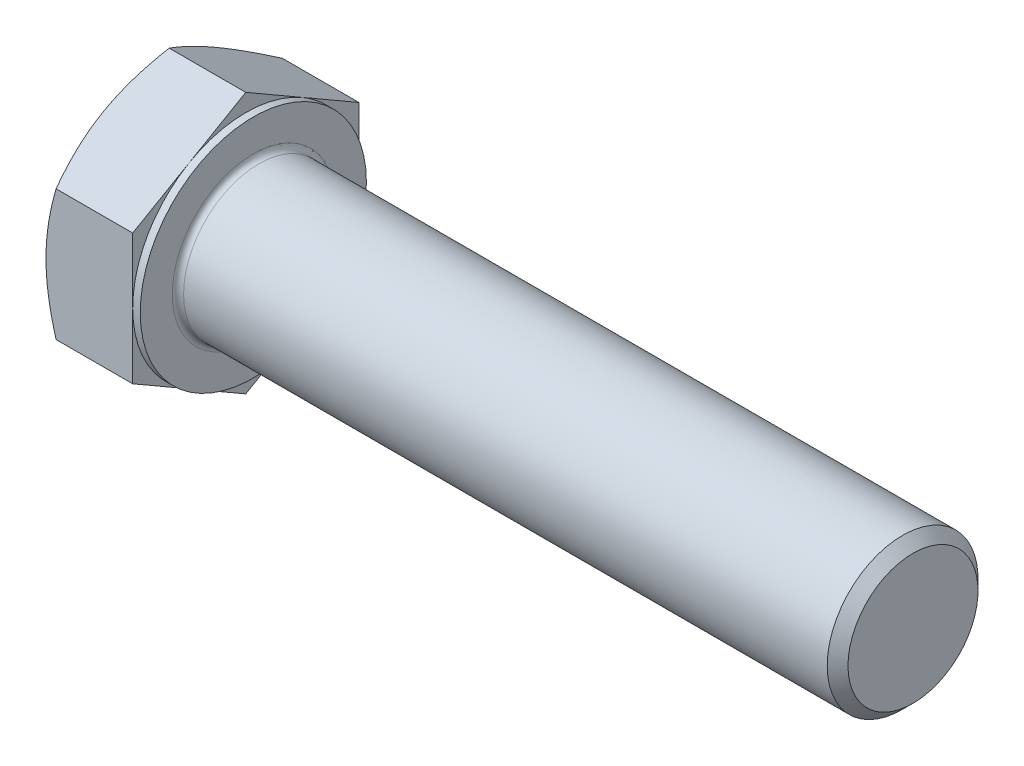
SolidWorks part; units mm, degrees
extrude "BaseHead" add sketch "Sketch1" along normal blind 10
sketch "Sketch1" plane through (0, 0, 0) normal (1, 0, 0) x (0, 0, -1)
  line L0 (12, 6.9282) -> (12, -6.9282)
  line L1 (-12, 6.9282) -> (-12, -6.9282)
  line L2 (12, -6.9282) -> (0, -13.8564)
  line L3 (0, -13.8564) -> (-12, -6.9282)
  line L4 (12, 6.9282) -> (0, 13.8564)
  line L5 (0, 13.8564) -> (-12, 6.9282)
revolve "HeadChamfer" cut sketch "Sketch3" angle 360 about L6
sketch "Sketch3" plane through (0, 0, 0) normal (0, 0, 1) x (1, 0, 0)
  line L0 (0, 12) -> (3.9585, 18.8564)
  line L1 (0, 13.8564) -> (0, 6.9282) construction
  line L2 (3.9585, 18.8564) -> (3.9585, 23.8564)
  line L3 (3.9585, 23.8564) -> (-10, 23.8564)
  line L4 (-10, 23.8564) -> (-10, 12)
  line L5 (-10, 12) -> (0, 12)
  line L6 (0, 0) -> (99.06, 0) construction
  line L7 (10, 13.8564) -> (0, 13.8564) construction
ref_plane "Plane1" through (0, 0, 0) normal (0, 0, 1) x (1, 0, 0)
ref_plane "Plane2" through (0, 0, 0) normal (0, 1, 0) x (1, 0, 0)
ref_plane "Plane3" through (0, 0, 0) normal (1, 0, 0) x (0, 0, -1)
sketch "BodySke" plane through (0, 0, 0) normal (0, 0, 1) x (1, 0, 0)
  line L0 (0, 6.9282) -> (0, -6.9282) construction
  line L1 (0, 0) -> (80, 0)
  line L2 (0, 0) -> (0, 8)
  line L3 (0, 8) -> (78.8985, 8)
  line L4 (80, 0) -> (80, 6.8985)
  line L5 (10, 13.8564) -> (10, 6.9282) construction
  line L6 (80, 6.8985) -> (78.8985, 8)
  line L7 (0, 0) -> (96.52, 0) construction
  line L8 (80, -6.8985) -> (78.8985, -8) construction
  line L9 (0, -8) -> (78.8985, -8) construction
  line L10 (12, 15.24) -> (12, -1.27) construction
  line L12 (10, 6.9282) -> (10, -6.9282) construction
revolve "BaseBody" add sketch "BodySke"
fillet "HeadFillet" radius 0.6 1 edges at (10, 0, -8)
sketch "Sketch4" plane through (0, 0, 0) normal (0, 0, 1) x (1, 0, 0)
  line L1 (10, 13.8564) -> (10, 6.9282) construction
  line L2 (10, 12) -> (9.2, 12)
  line L3 (10, 12) -> (10, 23.8564)
  line L4 (10, 23.8564) -> (9.2, 23.8564)
  line L5 (0, 0) -> (95.25, 0) construction
  line L6 (0, 0) -> (96.52, 0) construction
  line L7 (9.2, 12) -> (9.2, 23.8564)
  line L8 (10, 13.8564) -> (1.0718, 13.8564) construction
revolve "BearingFace" cut sketch "Sketch4" angle 360 about L5
sketch "ThdSchSke" plane through (0, 0, 0) normal (0, 0, 1) x (1, 0, 0)
  line L0 (12, -6.8985) -> (11.2287, -8)
  line L1 (12, -6.8985) -> (12.7713, -8)
  line L2 (12.7713, -8) -> (12.7713, -10)
  line L3 (-3.175, 0) -> (5.1513, 0) construction
  line L5 (12.7713, -10) -> (11.2287, -10)
  line L6 (11.2287, -10) -> (11.2287, -8)
revolve "ThreadSchematic" [suppressed] cut sketch "ThdSchSke" angle 360 about L3
pattern_linear "ThdSchPat" [suppressed]
equation "\"D3@Sketch1\" = \"Width_flats@Sketch1\" / 2"
equation "\"D4@Sketch1\" = \"D3@Sketch1\""
equation "\"D5@Sketch1\" = \"D4@Sketch1\""
equation "\"Thread_minor@ThreadCosmetic\" = \"Minor_dia@BodySke\""
equation "\"D1@Sketch3\" = \"Width_flats@Sketch1\" / 2"
equation "\"D1@Sketch4\" = \"Width_flats@Sketch1\""
equation "\"Thread_length@ThreadCosmetic\" = \"Length@BodySke\" - \"Advance@BodySke\""
equation "\"Thread_minor@ThdSchSke\" = \"Minor_dia@BodySke\""
equation "\"Diameter@ThdSchSke\" = \"Diameter@BodySke\""
equation "\"Overcut@ThdSchSke\" = \"Diameter@BodySke\" * 1.25"
equation "\"Start@ThdSchSke\" = \"Head_ht@BaseHead\" + \"Length@BodySke\" - \"Thread_length@ThreadCosmetic\"  '---Non-countersunk---"
equation "\"Num_threads@ThdSchPat\" = int( \"Thread_length@ThreadCosmetic\" / \"Advance@BodySke\" + 0.999 )  + 1"
equation "\"Advance@ThdSchPat\" = \"Thread_length@ThreadCosmetic\" /  (\"Num_threads@ThdSchPat\" - 1) 'relax it"
equation "\"Num_threads@ThdSchPat\" = \"Num_threads@ThdSchPat\" - sgn( \"Num_threads@ThdSchPat\" - 1) '---chamfered tips only---"
